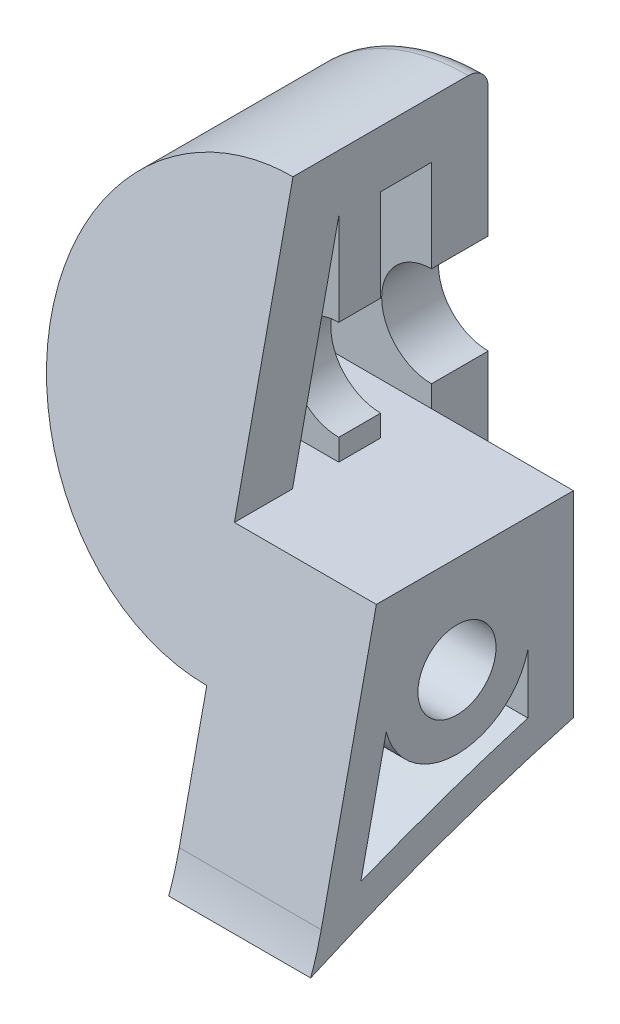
SolidWorks part; units mm, degrees
ref_plane "Plan de face" through (0, 0, 0) normal (0, 0, 1) x (1, 0, 0)
ref_plane "Plan de dessus" through (0, 0, 0) normal (0, 1, 0) x (1, 0, 0)
ref_plane "Plan de droite" through (0, 0, 0) normal (1, 0, 0) x (0, 0, -1)
mirrored part "demi patte de maintien du couvercle_Rendre symétrique"
other "<demi patte de maintien du couvercle>-<Extrusion3>"
